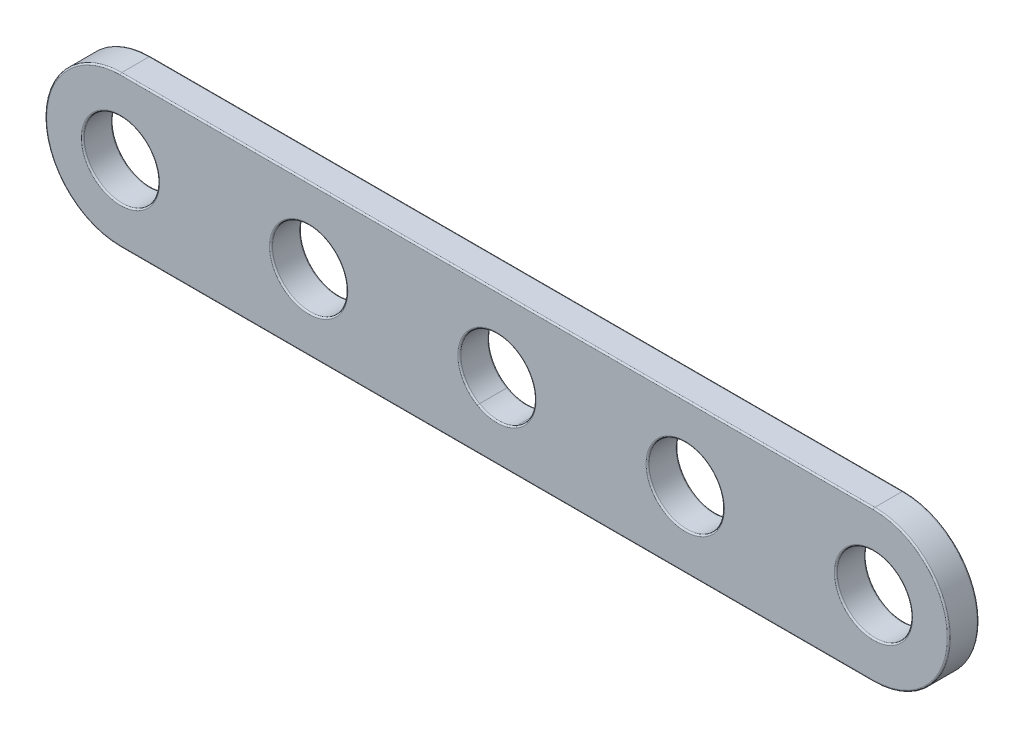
SolidWorks part; units mm, degrees
ref_plane "Front" through (0, 0, 0) normal (0, 0, 1) x (1, 0, 0)
ref_plane "Top" through (0, 0, 0) normal (0, 1, 0) x (1, 0, 0)
ref_plane "Right" through (0, 0, 0) normal (1, 0, 0) x (0, 0, -1)
sketch "Sketch1" plane through (0, 0, 0) normal (0, 0, 1) x (1, 0, 0)
  line L0 (250, 222.6284) -> (250, -151.5336) construction
  line L1 (0, 0) -> (500, 0)
  line L3 (0, 100) -> (500, 100)
  arc A0 (0, 100) -> (0, 0) centre (0, 50) ccw
  arc A1 (500, 100) -> (500, 0) centre (500, 50) cw
  point P1 (250, 0)
  point P10 (250, 100)
  dimension "D2" = 500
  dimension "D1" = 100
extrude "Base-Extrude" add sketch "Sketch1" along normal blind 20
sketch "Sketch2" plane through (0, 0, 20) normal (0, 0, 1) x (1, 0, 0)
  circle A0 centre (0, 50) radius 25
  arc A1 (0, 100) -> (0, 0) centre (0, 50) ccw construction
  dimension "D1" = 50
extrude "Cut-Extrude1" cut sketch "Sketch2" against normal through all
pattern_linear "LPattern1" count 5 spacing 125 along (1, 0, 0) of "Cut-Extrude1"
sketch "Sketch6" plane through (0, 0, 0) normal (0, 1, 0) x (1, 0, 0)
  line L0 (250, 24.303) -> (250, -37.3782) construction
  line L1 (250, 0) -> (250, -20) construction
  line L2 (500, -20) -> (0, -20) construction
  line L3 (500, 0) -> (0, 0) construction
  line L4 (262.5, -20) -> (237.5, -20)
  line L5 (262.5, 0) -> (237.5, 0)
  line L6 (262.5, 0) -> (262.5, -20)
  line L7 (237.5, 0) -> (237.5, -20)
  dimension "D1" = 25
fillet "Fillet1" radius 1 24 edges at (250, 100, 20) (550, 50, 20) (250, 0, 20) (-50, 50, 20) (25, 50, 20) (150, 50, 20) (400, 50, 20) (525, 50, 20) (250, 0, 0) (550, 50, 0) (250, 100, 0) (-50, 50, 0) (25, 50, 0) (150, 50, 0) (400, 50, 0) (525, 50, 0) (250, 75, 20) (275, 50, 20) (250, 25, 20) (225, 50, 20) (250, 75, 0) (225, 50, 0) (250, 25, 0) (275, 50, 0)
sketch "Sketch3" plane through (0, 0, 20) normal (0, 0, 1) x (1, 0, 0)
  line L0 (250, 189.4512) -> (250, -67.8587)
  circle A0 centre (0, 50) radius 25 construction
  dimension "D1" = 250
extrude "Cut-Extrude2" [suppressed] cut sketch "Sketch3" against normal through all and the other way through all
equation "\"D3@LPattern1\" = \"D2@Sketch1\" / (\"D1@LPattern1\"-1)"
